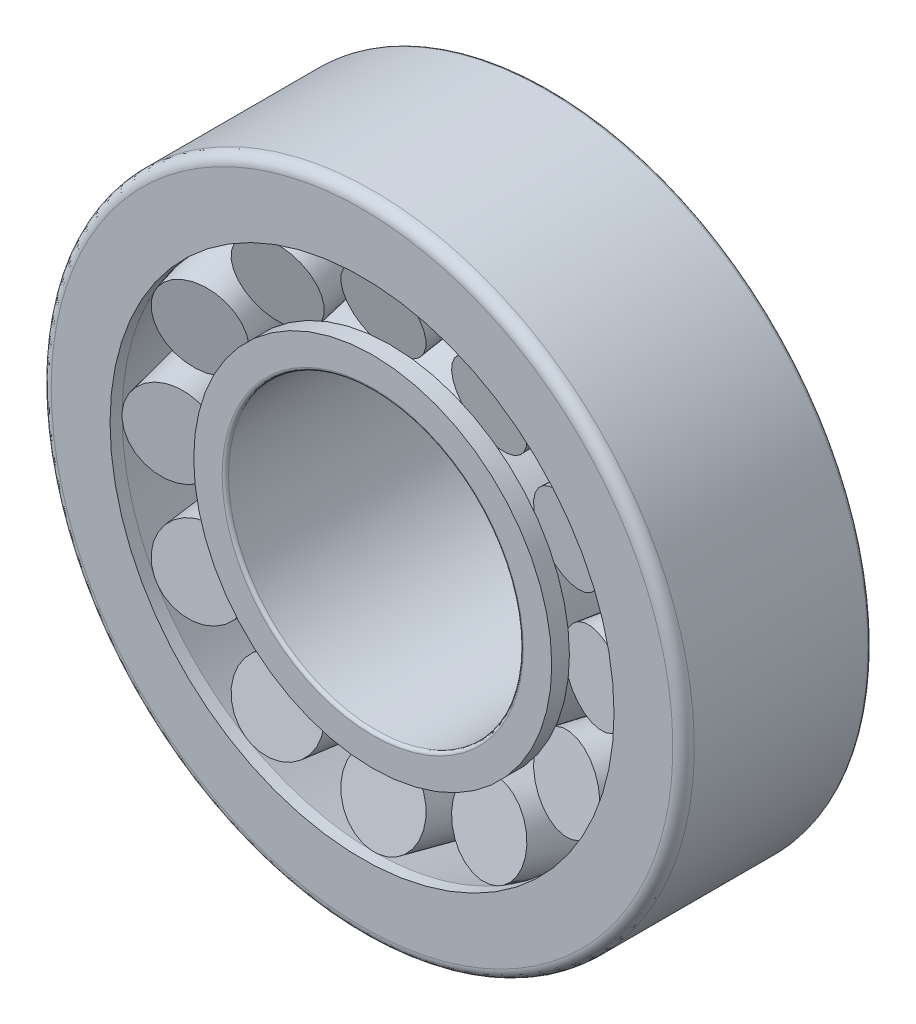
SolidWorks part; units mm, degrees
ref_plane "Front Plane" through (0, 0, 0) normal (0, 0, 1) x (1, 0, 0)
ref_plane "Top Plane" through (0, 0, 0) normal (0, 1, 0) x (1, 0, 0)
ref_plane "Right Plane" through (0, 0, 0) normal (1, 0, 0) x (0, 0, -1)
other "Configuration Table"
sketch "BaseSke" plane through (0, 0, 0) normal (1, 0, 0) x (0, 0, -1)
  line L0 (-47.2296, 0) -> (24.6132, 0) construction
  line L2 (0, 129.5214) -> (0, -86.3012) construction
  line L3 (-2.1506, 48.448) -> (-42.8494, 39.052) construction
  line L4 (-45, 60) -> (-10, 60) construction
  line L5 (-43, 27.5) -> (0, 27.5) construction
  line L6 (-22.5, 43.75) -> (-28.5892, 70.1254) construction
  line L7 (-42.75, 47.0507) -> (-12.25, 54.9386)
  line L8 (-12.25, 54.9386) -> (-10.3163, 46.5628)
  line L9 (-10.3163, 46.5628) -> (-41.0018, 39.4785)
  line L10 (-41.0018, 39.4785) -> (-42.75, 47.0507)
  line L11 (-45, 60) -> (-45, 47.0312) construction
  line L12 (-42.7455, 47.0312) -> (-10, 55.4998) construction
  line L13 (-10, 60) -> (-10, 55.4998) construction
  line L14 (-42.7455, 47.0312) -> (-45, 47.0312) construction
  line L15 (-39.2536, 31.9063) -> (-8.3826, 38.1871) construction
  line L16 (-43, 27.5) -> (-43, 33.4063) construction
  line L17 (-43, 33.4063) -> (-39.7026, 33.4063) construction
  line L18 (0, 39.6871) -> (0, 27.5) construction
  line L19 (-39.7026, 33.4063) -> (-39.3629, 31.9351) construction
  line L20 (-39.3629, 31.9351) -> (-8.2958, 38.2558) construction
  line L21 (-8.2958, 38.2558) -> (-8.6263, 39.6871) construction
  line L22 (-8.6263, 39.6871) -> (0, 39.6871) construction
revolve "Roller" add sketch "BaseSke" angle 360 about L3
sketch "OuterRaceSke" plane through (0, 0, 0) normal (1, 0, 0) x (0, 0, -1)
  line L0 (-42.7455, 47.0312) -> (-45, 47.0312) construction
  line L1 (-42.7455, 47.0312) -> (-10, 55.4998) construction
  line L2 (-10, 60) -> (-10, 55.4998) construction
  line L3 (-45, 60) -> (-10, 60) construction
  line L4 (-45, 60) -> (-45, 47.0312) construction
  line L5 (-42.7455, 47.0312) -> (-45, 47.0312)
  line L6 (-42.7455, 47.0312) -> (-10, 55.4998)
  line L7 (-10, 60) -> (-10, 55.4998)
  line L8 (-45, 60) -> (-10, 60)
  line L9 (-45, 60) -> (-45, 47.0312)
  line L10 (-60.3939, 0) -> (35.9926, 0) construction
revolve "OuterRace" add sketch "OuterRaceSke" angle 360 about L10
sketch "InnerRaceSke" plane through (0, 0, 0) normal (1, 0, 0) x (0, 0, -1)
  line L0 (-43, 27.5) -> (0, 27.5) construction
  line L1 (-43, 27.5) -> (-43, 33.4063) construction
  line L2 (-43, 33.4063) -> (-39.7026, 33.4063) construction
  line L3 (-39.7026, 33.4063) -> (-39.3629, 31.9351) construction
  line L4 (-39.3629, 31.9351) -> (-8.2958, 38.2558) construction
  line L5 (-8.2958, 38.2558) -> (-8.6263, 39.6871) construction
  line L6 (-8.6263, 39.6871) -> (0, 39.6871) construction
  line L7 (0, 39.6871) -> (0, 27.5) construction
  line L8 (-43, 27.5) -> (0, 27.5)
  line L9 (-43, 27.5) -> (-43, 33.4063)
  line L10 (-43, 33.4063) -> (-39.7026, 33.4063)
  line L11 (-39.7026, 33.4063) -> (-39.3629, 31.9351)
  line L12 (-39.3629, 31.9351) -> (-8.2958, 38.2558)
  line L13 (-8.2958, 38.2558) -> (-8.6263, 39.6871)
  line L14 (-8.6263, 39.6871) -> (0, 39.6871)
  line L15 (0, 39.6871) -> (0, 27.5)
  line L16 (-58.1022, 0) -> (39.538, 0) construction
revolve "InnerRace" add sketch "InnerRaceSke" angle 360 about L16
fillet "Fillet1" radius 0.6 2 edges at (60, 0, 10) (27.5, 0, 43)
fillet "InnerFillet" radius 2.5 1 edges at (27.5, 0, 0)
fillet "OuterFillet" radius 2 1 edges at (60, 0, 45)
pattern_circular "CirPatternBall" count 12 over 360 about axis through (0, 0, 0) along (0, 0, 1) of "Roller"
sketch "Sketch4" plane through (0, 0, 0) normal (1, 0, 0) x (0, 0, -1)
  line L0 (-42.75, 47.0507) -> (-12.25, 54.9386)
  line L1 (-12.25, 54.9386) -> (-8.3826, 38.1871)
  line L2 (-8.3826, 38.1871) -> (-39.2536, 31.9063)
  line L3 (-39.2536, 31.9063) -> (-42.75, 47.0507)
  line L4 (-40.3293, 0) -> (19.5574, 0) construction
revolve "Simplified" [suppressed] add sketch "Sketch4" angle 360 about L4
equation "\"D2@BaseSke\" = \"Bearing_Thickness@BaseSke\"/2"
equation "\"D3@BaseSke\" =  ( \"Bearing_Outside_Diameter@BaseSke\" + \"Bearing_Inside_Diameter@BaseSke\" )  / 2"
equation "\"Roller_diameter@BaseSke\" = \"D3@BaseSke\"*1.075"
equation "\"D4@BaseSke\" = \"Bearing_Thickness@BaseSke\"/20"
equation "\"D5@BaseSke\" = \"Bearing_Thickness@BaseSke\" / 20"
equation "\"D8@BaseSke\" = \"Bearing_Thickness@BaseSke\"/30"
equation "\"D11@BaseSke\" = \"D8@BaseSke\""
equation "\"D1@CirPatternBall\" = int(  \"D3@BaseSke\" *  pi  /  ( \"Bearing_Outside_Diameter@BaseSke\" - \"Bearing_Inside_Diameter@BaseSke\" )  * 3 ) "
